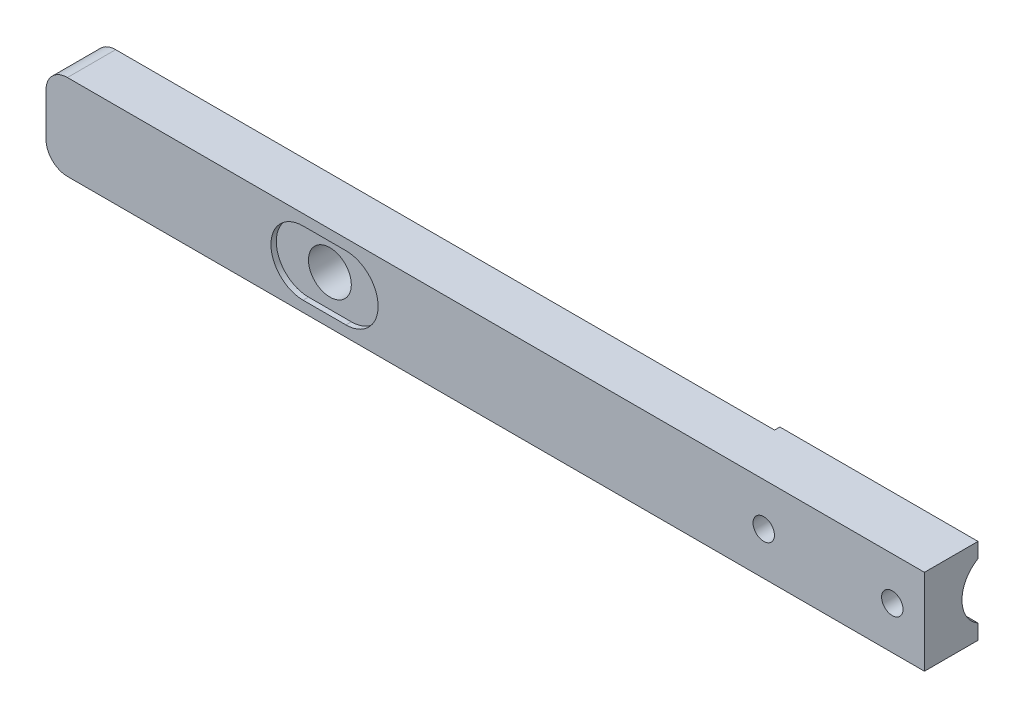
SolidWorks part; units mm, degrees
ref_plane "Front Plane" through (0, 0, 0) normal (0, 0, 1) x (1, 0, 0)
ref_plane "Top Plane" through (0, 0, 0) normal (0, 1, 0) x (1, 0, 0)
ref_plane "Right Plane" through (0, 0, 0) normal (1, 0, 0) x (0, 0, -1)
sketch "Sketch1" plane through (0, 0, 0) normal (0, 0, 1) x (1, 0, 0)
  line L0 (0, 0) -> (177.8, 0) construction
  line L1 (-82.55, -12.7) -> (177.8, -12.7)
  line L2 (177.8, -12.7) -> (177.8, 12.7)
  line L3 (177.8, 12.7) -> (-82.55, 12.7)
  line L4 (-82.55, 12.7) -> (-82.55, -12.7)
  circle A0 centre (0, 0) radius 6.35
  circle A1 centre (168.275, 0) radius 3.175
  circle A2 centre (130.175, 0) radius 3.175
  dimension "D4" = 12.7
  dimension "D5" = 6.35
  dimension "D1" = 82.55
  dimension "D2" = 25.4
  dimension "D3" = 177.8
  dimension "D6" = 38.1
  dimension "D7" = 9.525
  dimension "D8" = 130.175
extrude "Boss-Extrude1" add sketch "Sketch1" along normal mid plane 15.875
fillet "Fillet1" radius 6.35 2 edges at (-82.55, -12.7, 0) (-82.55, 12.7, 0)
sketch "Sketch2" plane through (177.8, 0, 0) normal (1, 0, 0) x (0, 0, -1)
  circle A0 centre (12.7, 0) radius 9.525
  dimension "D1" = 19.05
  dimension "D2" = 12.7
extrude "Cut-Extrude1" cut sketch "Sketch2" against normal blind 57.15
sketch "Sketch3" plane through (0, 0, 0) normal (0, 1, 0) x (1, 0, 0)
  line L0 (119.0752, 7.9375) -> (119.0752, 6.3627)
  line L1 (177.8, 7.9375) -> (-76.2, 7.9375) construction
  line L2 (119.0752, 6.3627) -> (-82.55, 6.3627)
  line L3 (-82.55, -7.9375) -> (-82.55, 7.9375) construction
  line L4 (-82.55, 6.3627) -> (-82.55, 7.9375)
  line L5 (-82.55, 7.9375) -> (119.0752, 7.9375)
  line L6 (177.8, -7.9375) -> (177.8, 7.9375) construction
  dimension "D1" = 1.5748
  dimension "D2" = 58.7248
extrude "Cut-Extrude2" cut sketch "Sketch3" against normal mid plane 50.8
sketch "Sketch4" plane through (0, 0, 0) normal (0, 0, 1) x (1, 0, 0)
  line L0 (-6.35, 0) -> (6.35, 0) construction
  line L1 (-6.35, 9.525) -> (6.35, 9.525)
  line L2 (-6.35, -9.525) -> (6.35, -9.525)
  arc A0 (-6.35, 9.525) -> (-6.35, -9.525) centre (-6.35, 0) ccw
  arc A1 (6.35, -9.525) -> (6.35, 9.525) centre (6.35, 0) ccw
  point P2 (0, 0)
  dimension "D1" = 9.525
  dimension "D2" = 6.35
extrude "Cut-Extrude3" cut sketch "Sketch4" along normal blind 50.8 from offset 6.35
